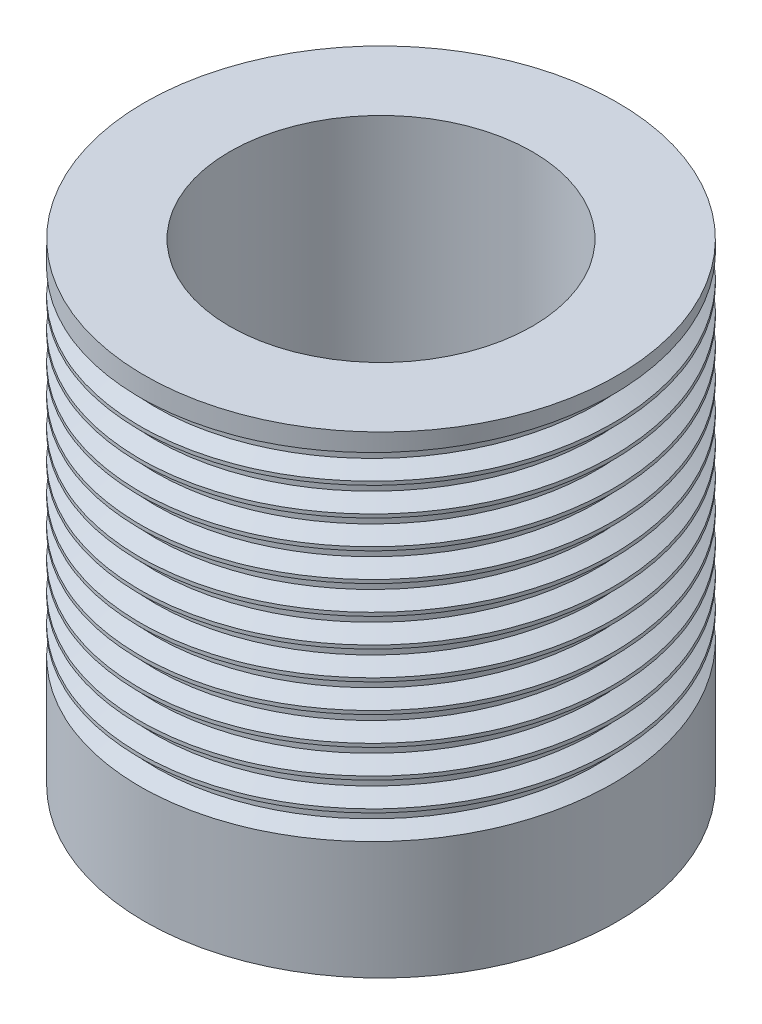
SolidWorks part; units mm, degrees
ref_plane "Front Plane" through (0, 0, 0) normal (0, 0, 1) x (1, 0, 0)
ref_plane "Top Plane" through (0, 0, 0) normal (0, 1, 0) x (1, 0, 0)
ref_plane "Right Plane" through (0, 0, 0) normal (1, 0, 0) x (0, 0, -1)
sketch "Sketch3" plane through (0, 0, 0) normal (0, 1, 0) x (1, 0, 0)
  circle A0 centre (-42.4517, 46.6969) radius 12.5
extrude "Boss-Extrude2" add sketch "Sketch3" along normal blind 25
sketch "Sketch4" plane through (0, 25, 0) normal (0, 1, 0) x (1, 0, 0)
  circle A0 centre (-42.4517, 46.6969) radius 8
  circle A1 centre (-42.4517, 46.6969) radius 12.5 construction
  dimension "D1" = 0
extrude "Cut-Extrude1" cut sketch "Sketch4" against normal blind 25 contours A0
thread "Thread1" pitch 1.5 start angle 0, offset 0, length 18, pitch 1.5, diameter 25
ref_plane "Plane1" through (-54.9517, 25, -46.6969) normal (0, 0, 1) x (-1, 0, 0)
sketch "Thread Profile1" plane through (-54.9517, 25, -46.6969) normal (0, 0, 1) x (-1, 0, 0)
  line L0 (0, 0) -> (0, 1.5) construction
  line L11 (0, 0) -> (0, 1.3125)
  line L12 (0, 1.3125) -> (-0.8119, 0.8437)
  line L13 (-0.8119, 0.8437) -> (-0.8119, 0.4687)
  line L15 (-0.8119, 0.4687) -> (0, 0)
  line L17 (-0.8119, 0.6562) -> (0, 0.6562) construction
  point P2 (0, 0)
  dimension "Pitch" = 1.5
  dimension "Profile_Angle" = 60
  dimension "Profile_Land" = 0.375
  dimension "Profile_Height" = 0.8119
